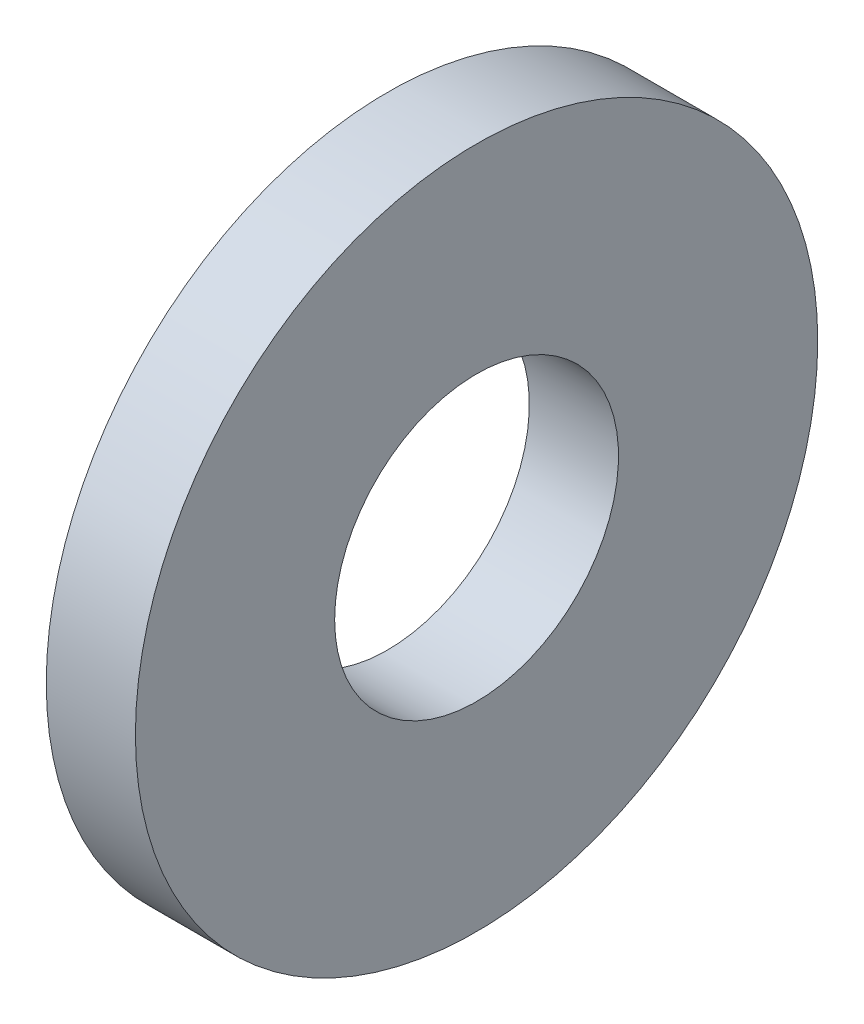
SolidWorks part; units mm, degrees
ref_plane "Plane1" through (0, 0, 0) normal (0, 0, 1) x (1, 0, 0)
ref_plane "Plane2" through (0, 0, 0) normal (0, 1, 0) x (1, 0, 0)
ref_plane "Plane3" through (0, 0, 0) normal (1, 0, 0) x (0, 0, -1)
revolve "Base-Revolve" add sketch "Sketch1" angle 360 about L0
sketch "Sketch1" plane through (0, 0, 0) normal (0, 0, 1) x (1, 0, 0)
  line L0 (-34.925, 0) -> (9.525, 0) construction
  line L1 (0, 1.9812) -> (0, 4.7625)
  line L2 (0, 4.7625) -> (-1.2446, 4.7625)
  line L3 (-1.2446, 4.7625) -> (-1.2446, 1.9812)
  line L4 (-1.2446, 1.9812) -> (0, 1.9812)
  dimension "Thickness" = 1.2446
  dimension "Inside_dia" = 3.9624
  dimension "Outside_dia" = 9.525
